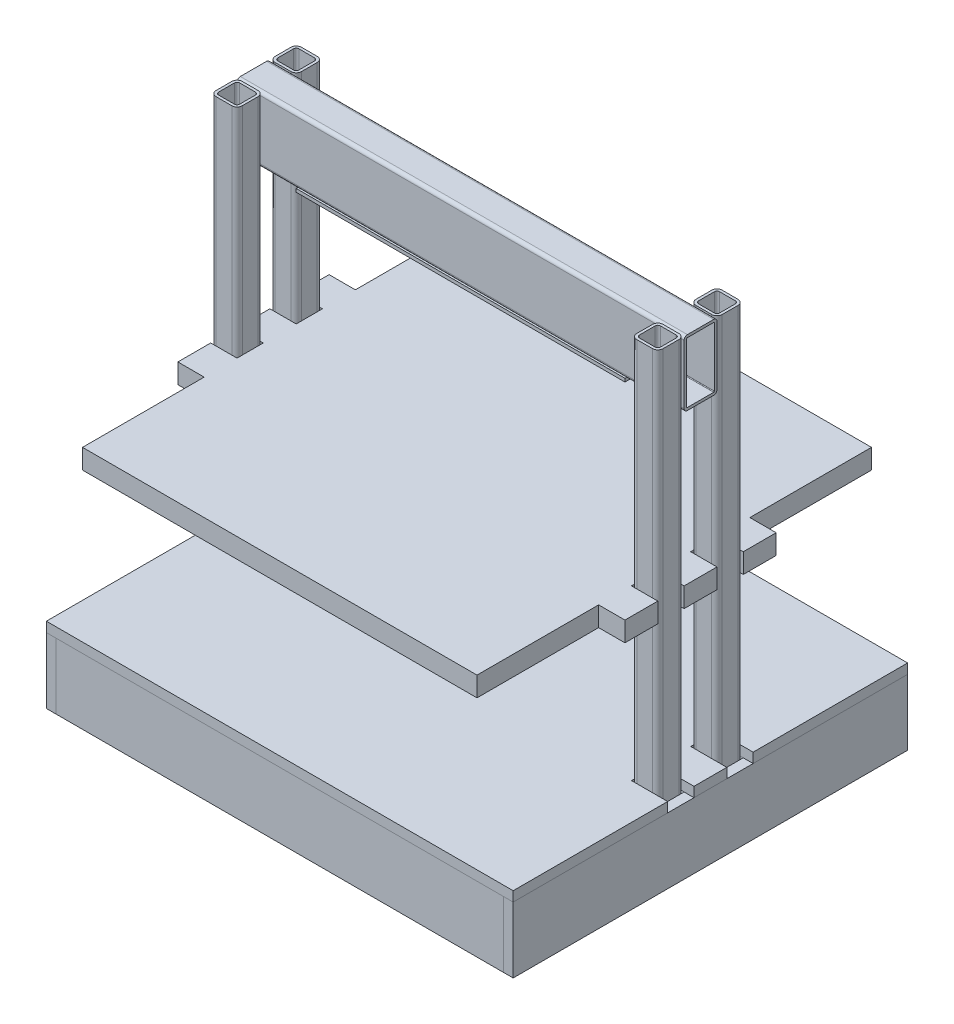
SolidWorks part; units mm, degrees
ref_plane "Plan de face" through (0, 0, 0) normal (0, 0, 1) x (1, 0, 0)
ref_plane "Plan de dessus" through (0, 0, 0) normal (0, 1, 0) x (1, 0, 0)
ref_plane "Plan de droite" through (0, 0, 0) normal (1, 0, 0) x (0, 0, -1)
ref_plane "Plan1" through (0, 0, 25) normal (0, 0, 1) x (1, 0, 0)
sketch "Esquisse2" plane through (0, 0, 25) normal (0, 0, 1) x (1, 0, 0)
  line L0 (-300, 0) -> (-300, 700)
  line L1 (0, 0) -> (0, 800) construction
  line L2 (300, 0) -> (300, 700)
  dimension "D1" = 700
  dimension "D2" = 600
ref_plane "Plan2" through (0, 0, -25) normal (0, 0, 1) x (1, 0, 0)
sketch "Esquisse3" plane through (0, 0, -25) normal (0, 0, 1) x (1, 0, 0)
  line L0 (300, 0) -> (300, 700) construction
  line L1 (-300, 0) -> (-300, 700) construction
  line L2 (300, 0) -> (300, 700)
  line L3 (-300, 0) -> (-300, 700)
other "Square tube - configured 40 X 40 X 4(1)"
ref_plane "Plan3" through (-320, 0, 45) normal (0, 1, 0) x (-1, 0, 0)
sketch "Sketch1" plane through (-320, 0, 45) normal (0, 1, 0) x (-1, 0, 0)
  line L0 (-12, -16) -> (12, -16)
  line L1 (-16, -12) -> (-16, 12)
  line L2 (12, 16) -> (-12, 16)
  line L3 (16, 12) -> (16, -12)
  line L4 (-12, -20) -> (12, -20)
  line L5 (-20, -12) -> (-20, 12)
  line L6 (12, 20) -> (-12, 20)
  line L7 (20, 12) -> (20, -12)
  arc A0 (20, 12) -> (12, 20) centre (12, 12) ccw
  arc A1 (12, -20) -> (20, -12) centre (12, -12) ccw
  arc A2 (-20, -12) -> (-12, -20) centre (-12, -12) ccw
  arc A3 (-12, 20) -> (-20, 12) centre (-12, 12) ccw
  arc A4 (-12, 16) -> (-16, 12) centre (-12, 12) ccw
  arc A5 (16, 12) -> (12, 16) centre (12, 12) ccw
  arc A6 (12, -16) -> (16, -12) centre (12, -12) ccw
  arc A7 (-16, -12) -> (-12, -16) centre (-12, -12) ccw
  point P0 (-20, 0)
  point P1 (20, 0)
  point P2 (0, 20)
  point P3 (0, -20)
  point P4 (0, 0)
  point P5 (-20, -20)
  point P6 (20, -20)
  point P7 (20, 20)
  point P8 (-20, 20)
  point P33 (0, 0)
  dimension "D1" = 8
  dimension "Thickness" = 4
  dimension "V_leg" = 40
sketch "Esquisse9" plane through (-340, 0, 0) normal (-1, 0, 0) x (0, 0, 1)
  line L0 (25, 0) -> (25, 700) construction
  line L1 (20, 600) -> (-20, 600)
  line L2 (25, 605) -> (25, 695)
  line L3 (20, 700) -> (-20, 700)
  line L4 (-25, 605) -> (-25, 695)
  line L5 (25, 600) -> (-25, 700) construction
  line L6 (25, 700) -> (-25, 600) construction
  line L7 (20, 696) -> (-20, 696)
  line L8 (-21, 605) -> (-21, 695)
  line L9 (20, 604) -> (-20, 604)
  line L10 (21, 605) -> (21, 695)
  arc A0 (-20, 600) -> (-25, 605) centre (-20, 605) cw
  arc A1 (20, 600) -> (25, 605) centre (20, 605) ccw
  arc A2 (25, 695) -> (20, 700) centre (20, 695) ccw
  arc A3 (-20, 700) -> (-25, 695) centre (-20, 695) ccw
  arc A4 (-20, 696) -> (-21, 695) centre (-20, 695) ccw
  arc A5 (-20, 604) -> (-21, 605) centre (-20, 605) cw
  arc A6 (20, 604) -> (21, 605) centre (20, 605) ccw
  arc A7 (21, 695) -> (20, 696) centre (20, 695) ccw
  point P0 (0, 650)
  dimension "D2" = 5
  dimension "D1" = 100
  dimension "D3" = 4
extrude "Boss.-Extru.1" add sketch "Esquisse9" against normal up to surface (680 mm away) separate body
ref_plane "Plan6" through (0, 350, 0) normal (0, 1, 0) x (1, 0, 0)
mirror "Symétrie2" about plane through (0, 350, 0) normal (0, 1, 0)
sketch "Esquisse11" plane through (-340, 0, 0) normal (-1, 0, 0) x (0, 0, 1)
  line L5 (-20, 4) -> (20, 4)
  line L6 (-21, 95) -> (-21, 5)
  line L7 (20, 96) -> (-20, 96)
  line L8 (21, 5) -> (21, 95)
  line L9 (-20, 4) -> (20, 4)
  line L10 (-21, 95) -> (-21, 5)
  line L11 (20, 96) -> (-20, 96)
  line L12 (21, 5) -> (21, 95)
  arc A4 (-21, 5) -> (-20, 4) centre (-20, 5) ccw
  arc A5 (-20, 96) -> (-21, 95) centre (-20, 95) ccw
  arc A6 (21, 95) -> (20, 96) centre (20, 95) ccw
  arc A7 (20, 4) -> (21, 5) centre (20, 5) ccw
  arc A8 (-21, 5) -> (-20, 4) centre (-20, 5) ccw
  arc A9 (-20, 96) -> (-21, 95) centre (-20, 95) ccw
  arc A10 (21, 95) -> (20, 96) centre (20, 95) ccw
  arc A11 (20, 4) -> (21, 5) centre (20, 5) ccw
  dimension "D1" = 0
extrude "Boss.-Extru.2" add sketch "Esquisse11" against normal blind 50 separate body
mirror "Symétrie3" about plane through (0, 0, 0) normal (1, 0, 0)
sketch "Esquisse12" plane through (-340, 0, 0) normal (-1, 0, 0) x (0, 0, 1)
  line L0 (-20, 100) -> (20, 100) construction
  line L1 (-300, 0) -> (300, 0)
  line L2 (-300, 0) -> (-300, 100)
  line L3 (-300, 100) -> (300, 100)
  line L4 (300, 0) -> (300, 100)
  point P6 (0, 0)
  dimension "D1" = 600
extrude "Boss.-Extru.3" add sketch "Esquisse12" along normal blind 15 separate body
sketch "Esquisse13" plane through (0, 0, 65) normal (0, 0, 1) x (1, 0, 0)
  line L1 (-340, 0) -> (340, 0)
  line L2 (-340, 0) -> (-340, 100)
  line L3 (-340, 100) -> (340, 100)
  line L4 (340, 0) -> (340, 100)
extrude "Boss.-Extru.4" add sketch "Esquisse13" along normal blind 15 separate body
pattern_linear "Répétition linéaire1" count 3 spacing 110 along (0, 0, 1)
mirror "Symétrie4" about plane through (0, 0, 0) normal (1, 0, 0)
mirror "Symétrie5" about plane through (0, 0, 0) normal (0, 0, 1)
sketch "Esquisse14" plane through (0, 100, 0) normal (0, 1, 0) x (1, 0, 0)
  line L0 (340, -65) -> (-340, -65) construction
  line L1 (-355, 300) -> (355, 300)
  line L2 (-355, 300) -> (-355, 65)
  line L3 (-355, -300) -> (355, -300)
  line L4 (355, 300) -> (355, 65)
  line L5 (-300, -65) -> (-355, -65)
  line L6 (-300, -65) -> (-300, -25)
  line L7 (-300, -25) -> (-355, -25)
  line L9 (-308, -25) -> (-332, -25) construction
  line L10 (-300, -57) -> (-300, -33) construction
  line L11 (-355, 0) -> (355, 0) construction
  line L12 (0, 300) -> (0, -300) construction
  line L14 (300, -25) -> (355, -25)
  line L15 (300, -65) -> (300, -25)
  line L16 (300, -65) -> (355, -65)
  line L17 (300, 65) -> (355, 65)
  line L18 (300, 65) -> (300, 25)
  line L19 (300, 25) -> (355, 25)
  line L22 (-300, 25) -> (-355, 25)
  line L23 (-300, 65) -> (-300, 25)
  line L24 (-300, 65) -> (-355, 65)
  line L25 (-355, 25) -> (-355, -25)
  line L26 (-355, -65) -> (-355, -300)
  line L27 (355, 25) -> (355, -25)
  line L28 (355, -65) -> (355, -300)
  line L29 (340, -25) -> (-340, -25) construction
  line L30 (340, 25) -> (-340, 25) construction
extrude "Boss.-Extru.5" add sketch "Esquisse14" along normal blind 15 separate body
sketch "Esquisse15" plane through (0, 600, 0) normal (0, -1, 0) x (1, 0, 0)
  line L0 (340, 25) -> (-340, 25) construction
  line L1 (-250, 25) -> (250, 25)
  line L2 (-250, 25) -> (-250, -25)
  line L3 (-250, -25) -> (250, -25)
  line L4 (250, 25) -> (250, -25)
  line L5 (340, -25) -> (-340, -25) construction
  line L6 (0, 0) -> (0, 124.6994) construction
  dimension "D1" = 500
extrude "Boss.-Extru.6" add sketch "Esquisse15" along normal blind 5 separate body
ref_plane "Plan7" through (0, 371.5, 0) normal (0, 1, 0) x (1, 0, 0)
sketch "Esquisse18" plane through (0, 371.5, 0) normal (0, 1, 0) x (1, 0, 0)
  line L0 (355, 300) -> (-355, 300) construction
  line L1 (-300, 300) -> (300, 300)
  line L2 (-300, 300) -> (-300, 115)
  line L3 (-300, -300) -> (300, -300)
  line L4 (300, 300) -> (300, 115)
  line L5 (-355, -300) -> (355, -300) construction
  line L6 (300, -33) -> (300, -57) construction
  line L7 (-300, -25) -> (-300, -65) construction
  line L9 (-300, -25) -> (-340, -25)
  line L11 (-300, 25) -> (-340, 25)
  line L12 (-340, -25) -> (-340, 25)
  line L13 (-340, -33) -> (-340, -57) construction
  line L14 (-308, -25) -> (-332, -25) construction
  line L15 (-332, 25) -> (-308, 25) construction
  line L16 (-300, -25) -> (-300, -65)
  line L17 (340, -57) -> (340, -33) construction
  line L18 (300, -25) -> (340, -25)
  line L20 (300, 25) -> (340, 25)
  line L21 (340, -25) -> (340, 25)
  line L22 (332, -25) -> (308, -25) construction
  line L23 (308, 25) -> (332, 25) construction
  line L24 (300, -25) -> (300, -65)
  line L25 (308, -65) -> (332, -65) construction
  line L26 (300, -65) -> (340, -65)
  line L28 (300, -115) -> (340, -115)
  line L29 (340, -65) -> (340, -115)
  line L30 (300, 65) -> (355, 65) construction
  line L31 (300, 65) -> (340, 65)
  line L33 (300, 115) -> (340, 115)
  line L34 (340, 65) -> (340, 115)
  line L35 (340, 33) -> (340, 57) construction
  line L36 (0, 300) -> (0, -300) construction
  line L37 (-340, -65) -> (-340, -115)
  line L38 (-300, -115) -> (-340, -115)
  line L40 (-300, -65) -> (-340, -65)
  line L41 (-340, 65) -> (-340, 115)
  line L42 (-300, 115) -> (-340, 115)
  line L44 (-300, 65) -> (-340, 65)
  line L45 (-300, 65) -> (-300, 25)
  line L46 (-300, -115) -> (-300, -300)
  line L47 (300, -115) -> (300, -300)
  line L48 (300, 65) -> (300, 25)
extrude "Boss.-Extru.7" add sketch "Esquisse18" against normal blind 30 separate body
